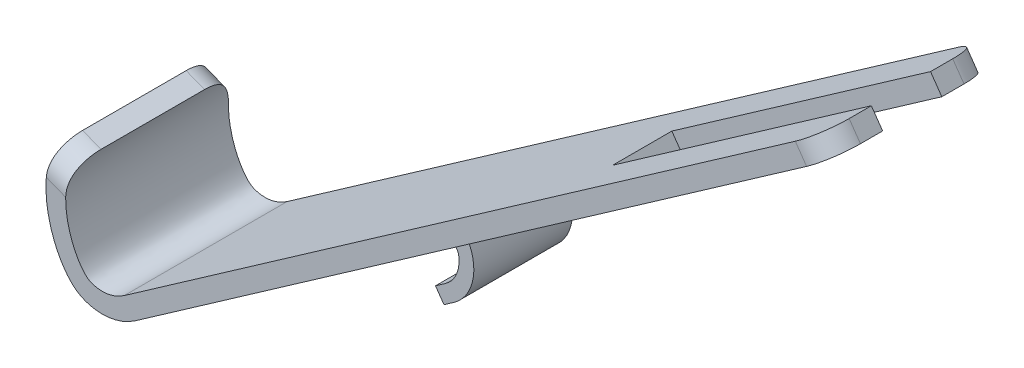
SolidWorks part; units mm, degrees
ref_plane "Front Plane" through (0, 0, 0) normal (0, 0, 1) x (1, 0, 0)
ref_plane "Top Plane" through (0, 0, 0) normal (0, 1, 0) x (1, 0, 0)
ref_plane "Right Plane" through (0, 0, 0) normal (1, 0, 0) x (0, 0, -1)
sketch "Sketch1" plane through (0, 0, 0) normal (0, 0, 1) x (1, 0, 0)
  line L1 (31.25, -8.5138) -> (28.8112, -17.6156)
  line L2 (2.6998, -31.2503) -> (-5.5718, -28.2633)
  line L3 (-36.4687, 0) -> (-36.4687, -17.1061) construction
  line L4 (-10.7157, 0) -> (24.7172, 0)
  line L5 (33.5313, 0) -> (23.1765, -38.6446) construction
  line L6 (33.5313, 0) -> (-36.4687, 0) construction
  line L7 (-36.4687, -17.1061) -> (23.1765, -38.6446) construction
  arc A1 (2.6998, -31.2503) -> (28.8112, -17.6156) centre (9.4927, -12.4392) ccw
  arc A2 (-10.7157, 0) -> (-36.4687, -10) centre (-10.7157, -38.1608) ccw
  arc A4 (-36.4687, -12.0303) -> (-5.5718, -28.2633) centre (37.7598, 91.7317) ccw
  arc A6 (31.25, -8.5138) -> (24.7172, 0) centre (24.7172, -6.7633) ccw
  dimension "D5" = 36.4687
  dimension "D8" = 20
  dimension "D1" = 75
  dimension "D2" = 70
  dimension "D3" = 10
extrude "MAIN BODY Extrude-Thin1" add sketch "Sketch1" along normal mid plane 16.5 thin
sketch "Sketch2"
sketch_block_instance "Block1-1"
sketch_block "Block1" parameters "D3"=5, "D1"=17, "D2"=3.5
extrude "BRACKETS Boss-Extrude1" add sketch "Sketch2" along normal up to surface and the other way up to vertex
sketch "Sketch3" plane through (32.734, -8.771, 0) normal (0.9659, -0.2588, 0) x (0, 0, -1)
  line L0 (0, 0) -> (0, -1.6356) construction
  line L1 (-3, -1.6356) -> (3, -1.6356)
  line L2 (-6, -4.6356) -> (-6, -6.6356)
  line L3 (-3, -9.6356) -> (3, -9.6356)
  line L4 (6, -4.6356) -> (6, -6.6356)
  line L5 (-8.25, -0.1356) -> (8.25, -0.1356) construction
  arc A0 (3, -1.6356) -> (6, -4.6356) centre (3, -4.6356) cw
  arc A1 (-3, -1.6356) -> (-6, -4.6356) centre (-3, -4.6356) ccw
  arc A2 (-6, -6.6356) -> (-3, -9.6356) centre (-3, -6.6356) ccw
  arc A3 (3, -9.6356) -> (6, -6.6356) centre (3, -6.6356) ccw
  dimension "D1" = 3
  dimension "D2" = 8
  dimension "D3" = 12
  dimension "D4" = 1.5
extrude "USB Cut-Extrude1" cut sketch "Sketch3" against normal up to surface (1.5 mm away)
ref_plane "Plane1" through (-38.0882, 0, 0) normal (1, 0, 0) x (0, 0, -1)
sketch "Sketch5" plane through (-38.0882, 0, 0) normal (1, 0, 0) x (0, 0, -1)
  line L0 (0, 0) -> (0, -13.2503) construction
  line L1 (-8.25, -13.2503) -> (8.25, -13.2503) construction
  line L2 (-8.25, -13.2503) -> (8.25, -13.2503) construction
ref_plane "Plane2" through (-22.2616, -26.5304, 0) normal (-0.6428, -0.766, 0) x (0, 0, -1)
ref_plane "Plane3" through (-0.6711, 3.4525, 0) normal (0.1908, -0.9816, 0) x (0, 0, -1)
sketch "Sketch7" plane through (-22.2616, -26.5304, 0) normal (-0.6428, -0.766, 0) x (0, 0, -1)
  line L0 (0, 0) -> (0, -20.9215) construction
  line L1 (-8.25, -20.6601) -> (8.25, -20.6601) construction
  line L2 (-8.25, -20.6601) -> (8.25, -20.6601) construction
  line L3 (0, -21.9094) -> (0, -27.9094) construction
  line L4 (4.5, -21.9094) -> (4.5, -27.9094)
  line L5 (-4.5, -21.9094) -> (-4.5, -27.9094)
  arc A2 (4.5, -21.9094) -> (-4.5, -21.9094) centre (0, -21.9094) ccw
  arc A3 (-4.5, -27.9094) -> (4.5, -27.9094) centre (0, -27.9094) ccw
  point P7 (0, -24.9094)
  point P9 (0, -20.6601)
  dimension "D1" = 4.5
  dimension "D2" = 6
extrude "AUDIO JACK Cut-Extrude3" cut sketch "Sketch7" against normal up to next
sketch "Sketch8" plane through (-0.2905, 3.5265, 0) normal (-0.1908, 0.9816, 0) x (0.9816, 0.1908, 0)
  line L0 (-0.3877, 0) -> (-18.9936, 0) construction
  circle A0 centre (-18.9936, 0) radius 6
  dimension "D1" = 12
extrude "STADIA BUTTON Cut-Extrude4" cut sketch "Sketch8" against normal up to surface and the other way up to surface
sketch "Sketch12" plane through (0, 0, 0) normal (0, 0, 1) x (1, 0, 0)
  line L1 (-3.5837, 50.75) -> (1.3312, 54.1915) construction
  line L2 (-8.2828, 0.75) -> (24.7172, 0.75) construction
  line L6 (24.7172, 1.5) -> (24.7172, 0) construction
  spline S0 degree 3 poles (-8.2828, 0.75) (-6.73, 3.2005) (-5.3886, 23.2076) (-5.5701, 37.4438) (-3.5837, 50.75) knots 0 0 0 0 0.2281 1 1 1 1
  spline S1 degree 3 poles (16.0609, 0.75) (1.7321, 13.756) (-1.2905, 35.6478) (1.3312, 54.1915) knots 0 0 0 0 1 1 1 1
  dimension "D1" = 6
  dimension "D2" = 33
  dimension "D3" = 50
  dimension "D4" = 35
extrude "Extrude-Thin1" add sketch "Sketch12" along normal up to surface and the other way up to surface thin
sketch "Sketch17" plane through (0, 0, 0) normal (0, 0, 1) x (1, 0, 0)
  line L1 (0.5886, 54.2965) -> (-4.3254, 50.8607) construction
  line L2 (49.762, 88.6764) -> (-20.7198, 39.3985)
  line L3 (-27.5958, 49.2332) -> (-20.7198, 39.3985) construction
  spline S0 degree 3 poles (-20.7198, 39.3985) (-22.2994, 38.2941) (-24.3521, 38.3454) (-27.0966, 39.8336) (-29.2482, 45.0519) (-27.5958, 49.2332) knots 0 0 0 0 0.304126 0.404126 1 1 1 1
  dimension "D1" = 86
  dimension "D2" = 60
  dimension "D7" = 12
extrude "Extrude-Thin3" add sketch "Sketch17" along normal up to surface and the other way up to surface thin
fillet "Fillet 3mm" radius 3 6 edges at (-27.5958, 49.2332, 8.25) (-27.5958, 49.2332, -8.25) (49.762, 88.6764, 8.25) (49.762, 88.6764, -8.25)
sketch "Sketch19" plane through (-24.7316, 35.3734, 0) normal (0.573, -0.8196, 0) x (0.8196, 0.573, 0)
  line L0 (91.5942, 5.25) -> (91.5942, -5.25) construction
  line L1 (91.5942, 3) -> (59.5942, 3)
  line L2 (91.5942, 3) -> (91.5942, -3)
  line L3 (91.5942, -3) -> (59.5942, -3)
  line L4 (59.5942, 3) -> (59.5942, -3)
  line L5 (91.5942, 0) -> (5.5942, 0) construction
  line L6 (91.5942, 0) -> (5.5942, 0) construction
  point P8 (59.5942, 0)
  dimension "D1" = 6
  dimension "D2" = 32
extrude "SLOT Cut-Extrude1" cut sketch "Sketch19" against normal up to next
sketch "Sketch20" plane through (0, 0, 8.25) normal (0, 0, 1) x (1, 0, 0)
  line L0 (-7.053, 1.5) -> (6.3548, 12.2457)
  line L1 (6.3548, 12.2457) -> (-5.1885, 17.4489)
  line L2 (-5.1885, 17.4489) -> (0.6165, 30.3273)
  line L3 (0.6165, 30.3273) -> (-4.5534, 32.6576)
  line L4 (-4.5534, 32.6576) -> (-0.272, 42.1558)
  line L5 (-0.272, 42.1558) -> (-3.1565, 51.678)
  line L6 (-2.5444, 50.8858) -> (-3.7687, 52.4702) construction
  line L7 (0.4089, 52.9507) -> (-2.8873, 50.646) construction
  line L8 (46.7303, 87.7769) -> (-21.2928, 40.218) construction
  spline S0 degree 3 poles (-7.053, 1.5) (-6.8554, 1.9659) (-6.6873, 2.4645) (-6.2653, 3.9756) (-6.0679, 5.0555) (-5.7674, 7.3175) (-5.6648, 8.4993) (-5.5439, 10.2781) (-5.5091, 10.872) (-5.4444, 12.0495) (-5.4142, 12.6322) (-5.152, 17.828) (-5.0055, 22.0988) (-4.5156, 34.4488) (-4.1224, 42.0621) (-2.8419, 50.6393) knots 0.029282 0.029282 0.029282 0.029282 0.0625 0.0625 0.125 0.125 0.1875 0.1875 0.21875 0.21875 0.25 0.25 0.5 0.5 1 1 1 1 construction
  spline S2 degree 3 poles (-7.053, 1.5) (-6.8554, 1.9659) (-6.6873, 2.4645) (-6.2653, 3.9756) (-6.0679, 5.0555) (-5.7674, 7.3175) (-5.6648, 8.4993) (-5.5439, 10.2781) (-5.5091, 10.872) (-5.4444, 12.0495) (-5.4142, 12.6322) (-5.152, 17.828) (-5.0055, 22.0988) (-4.5156, 34.4488) (-4.1224, 42.0621) (-2.8419, 50.6393) knots 0.029282 0.029282 0.029282 0.029282 0.0625 0.0625 0.125 0.125 0.1875 0.1875 0.21875 0.21875 0.25 0.25 0.5 0.5 1 1 1 1 construction
  spline S3 degree 3 poles (14.1847, 1.5) (11.1646, 4.5106) (8.6847, 7.9297) (4.3928, 15.86) (2.7323, 20.4579) (-0.5285, 34.2953) (-0.7193, 43.9722) (0.4089, 52.9507) knots 0.032141 0.032141 0.032141 0.032141 0.25 0.25 0.5 0.5 0.976115 0.976115 0.976115 0.976115 construction
  point P4 (-2.8419, 50.6393)
  point P19 (-3.1565, 51.678)
extrude "Extrude-Thin4" add sketch "Sketch20" against normal up to surface (16.5 mm away) thin
sketch "Sketch21" plane through (0, 0, 0) normal (0, 0, 1) x (1, 0, 0)
  line L0 (47.8763, 86.1378) -> (2.0403, 54.0912) construction
  line L1 (8.4301, 53.678) -> (7.4301, 52.9788)
  line L2 (6.1381, 56.9562) -> (8.4301, 53.678) construction
  arc A0 (9.4163, 59.2482) -> (8.4301, 53.678) centre (6.1381, 56.9562) cw
  dimension "D2" = 4
  dimension "D1" = 9
  dimension "D3" = 1
extrude "Extrude-Thin5" add sketch "Sketch21" along normal mid plane 10 thin
fillet "Fillet1" radius 1 27 edges at (16.3521, 1.5, 0) (-4.4779, 34.0419, 0) (-3.8921, 32.908, 0) (-0.2631, 40.9587, 0) (0.7614, 29.4321, 0) (5.4051, 12.1253, 0) (6.5928, 11.7958, 0) (-6.2535, 1.5, 0) (-8.7137, 1.5, 0) (-6.7146, 2.412, 0) (-5.1324, 18.7902, 0) (-4.5272, 17.6993, 0) (5.9897, 12.9587, 0) (-0.0448, 30.0769, 0) (-0.8049, 42.1903, 0) (0.5276, 30.9158, 0) (-0.2556, 43.8264, 0) (-2.4204, 50.9725, 0) (-4.522, 49.5032, 0) (0.4089, 52.9507, 0) (-3.0113, 49.4739, 0) (-4.581, 32.1216, 0) (-5.2118, 16.911, 0) (14.1847, 1.5, 0) (8.8016, 58.8185, 0) (10.031, 59.678, 0) (2.0739, 54.0865, 0)
fillet "Fillet2" [suppressed] radius 0.5
fillet "Fillet3" [suppressed] radius 0.5
sketch "Sketch23" plane through (0, 0, 8.25) normal (0, 0, 1) x (1, 0, 0)
  line L0 (-20.1468, 38.5789) -> (2.0403, 54.0912)
  line L1 (2.0403, 54.0912) -> (38.9939, 1.2367)
  line L2 (38.9939, 1.2367) -> (38.9939, -36.3022)
  line L3 (38.9939, -36.3022) -> (-53.0232, -36.3022)
  line L4 (-53.0232, -36.3022) -> (-53.0232, 13.6664)
  line L5 (-53.0232, 13.6664) -> (-31.8922, 17.8926)
  line L6 (-31.8922, 17.8926) -> (-20.1468, 38.5789)
extrude "Cut-Extrude2" cut sketch "Sketch23" against normal through all
